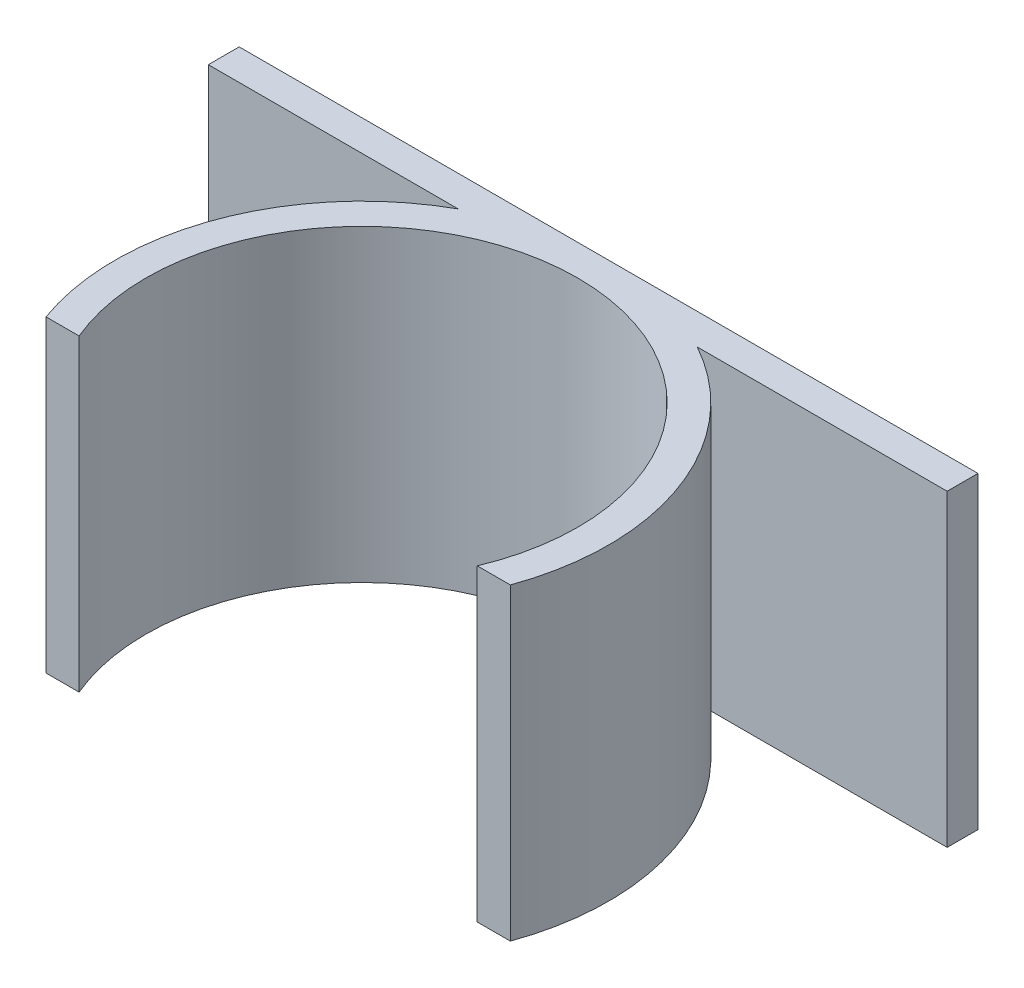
SolidWorks part; units mm, degrees
ref_plane "前视基准面" through (0, 0, 0) normal (0, 0, 1) x (1, 0, 0)
ref_plane "上视基准面" through (0, 0, 0) normal (0, 1, 0) x (1, 0, 0)
ref_plane "右视基准面" through (0, 0, 0) normal (1, 0, 0) x (0, 0, -1)
other "Configuration Table"
sketch "草图1" plane through (0, 0, 0) normal (0, 1, 0) x (1, 0, 0)
  circle A0 centre (0, 0) radius 7
  circle A1 centre (0, 0) radius 8
extrude "凸台-拉伸1" add sketch "草图1" along normal blind 10
sketch "草图2" plane through (0, 0, 0) normal (0, -1, 0) x (1, 0, 0)
  line L0 (0, -7) -> (0, -8)
  line L2 (-11.9753, -8) -> (11.9753, -8)
  line L3 (-11.9753, -8) -> (-11.9753, -7)
  line L4 (-11.9753, -7) -> (11.9753, -7)
  line L5 (11.9753, -8) -> (11.9753, -7)
  line L6 (-11.9753, -8) -> (11.9753, -7) construction
  line L7 (-11.9753, -7) -> (11.9753, -8) construction
  circle A0 centre (0, 0) radius 7 construction
  circle A1 centre (0, 0) radius 8 construction
  point P8 (0, -7.5)
extrude "凸台-拉伸2" add sketch "草图2" against normal blind 10 contours L2 L5 L4 L3
sketch "草图3" plane through (0, 10, 0) normal (0, 1, 0) x (1, 0, 0)
  line L1 (-8.9399, -8) -> (9.0427, -8)
  line L2 (-8.9399, -8) -> (-8.9399, -4.714)
  line L3 (-8.9399, -4.714) -> (9.0427, -4.714)
  line L4 (9.0427, -8) -> (9.0427, -4.714)
extrude "切除-拉伸1" cut sketch "草图3" against normal blind 10
sketch "草图4" plane through (0, 10, 0) normal (0, 1, 0) x (1, 0, 0)
  line L1 (-9.1968, -4.714) -> (10.4813, -4.714)
  line L2 (-9.1968, -4.714) -> (-9.1968, -2.7114)
  line L3 (-9.1968, -2.7114) -> (10.4813, -2.7114)
  line L4 (10.4813, -4.714) -> (10.4813, -2.7114)
extrude "切除-拉伸2" cut sketch "草图4" against normal blind 10
